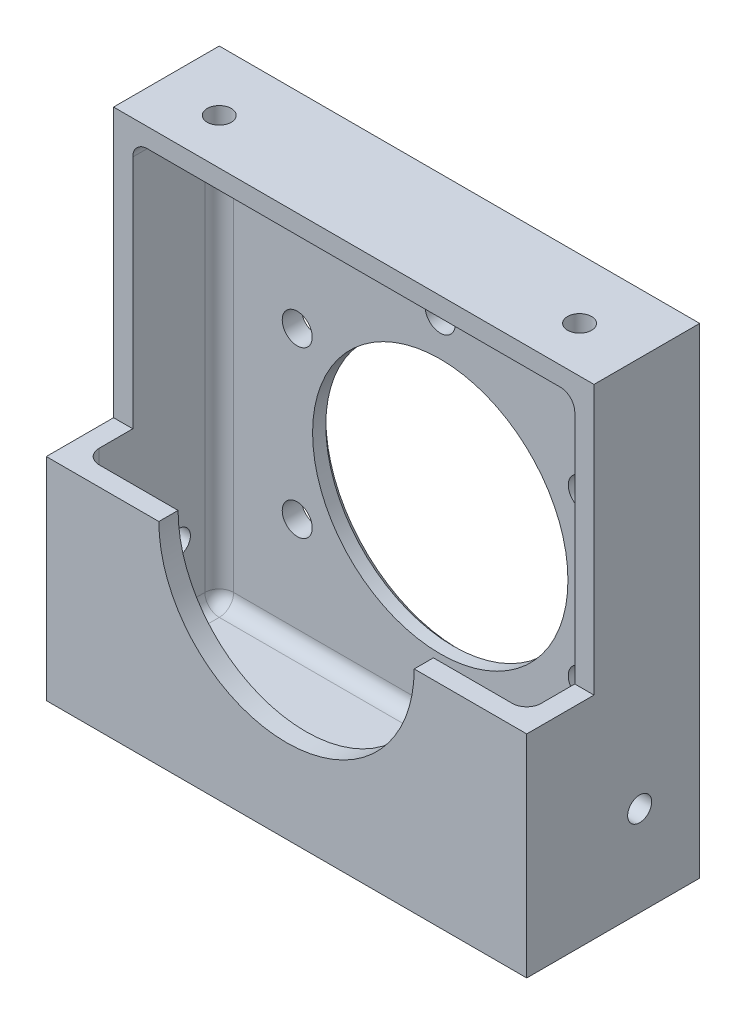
SolidWorks part; units mm, degrees
ref_plane "Front" through (0, 0, 0) normal (0, 0, 1) x (1, 0, 0)
ref_plane "Top" through (0, 0, 0) normal (0, 1, 0) x (1, 0, 0)
ref_plane "Right" through (0, 0, 0) normal (1, 0, 0) x (0, 0, -1)
sketch "Sketch1" plane through (0, 0, 0) normal (0, 0, 1) x (1, 0, 0)
  line L0 (0, 0) -> (50.8, 0)
  line L1 (0, 0) -> (0, 50.8)
  line L2 (50.8, 50.8) -> (0, 50.8)
  line L3 (50.8, 50.8) -> (50.8, 0)
  dimension "D1" = 50.8
extrude "main body" add sketch "Sketch1" along normal blind 18.288
sketch "Sketch2" plane through (50.8, 0, 0) normal (1, 0, 0) x (0, 0, -1)
  line L0 (-18.288, 50.8) -> (-11.176, 50.8)
  line L1 (-18.288, 50.8) -> (-18.288, 22.352)
  line L2 (-11.176, 22.352) -> (-18.288, 22.352)
  line L3 (-11.176, 22.352) -> (-11.176, 50.8)
  line L4 (-18.288, 0) -> (0, 0) construction
  line L5 (0, 50.8) -> (0, 0) construction
  dimension "D1" = 22.352
  dimension "D2" = 11.176
extrude "front cut" cut sketch "Sketch2" against normal through all
shell "Shell1" thickness 2.032
sketch "Sketch3" plane through (0, 0, 0) normal (0, 0, 1) x (1, 0, 0)
  line L0 (0, 22.352) -> (50.8, 22.352) construction
  circle A0 centre (25.4, 22.352) radius 13.5001
  dimension "D1" = 27.0002
extrude "center hole" cut sketch "Sketch3" along normal through all
fillet "fill060.vert" radius 1.524 4 edges at (2.032, 12.192, 16.256) (48.768, 12.192, 16.256) (2.032, 25.4, 2.032) (48.768, 25.4, 2.032)
fillet "fill060.tb" radius 1.524 13 edges at (2.032, 48.768, 7.366) (48.768, 48.768, 7.366) (2.032, 2.032, 9.144) (25.4, 48.768, 2.032) (48.3216, 48.768, 2.4784) (2.4784, 48.768, 2.4784) (25.4, 2.032, 2.032) (25.4, 2.032, 16.256) (48.768, 2.032, 9.144) (48.3216, 2.032, 15.8096) (48.3216, 2.032, 2.4784) (2.4784, 2.032, 15.8096) (2.4784, 2.032, 2.4784)
chamfer "cham025" distance 0.635 angle 45 1 edges at (38.9001, 22.352, 0)
sketch "Sketch4" plane through (0, 50.8, 0) normal (0, 1, 0) x (-1, 0, 0)
  line L0 (0, 6.35) -> (-50.8, 6.35) construction
  line L1 (0, 11.176) -> (0, 0) construction
  line L2 (-50.8, 11.176) -> (-50.8, 0) construction
  line L3 (-50.8, 0) -> (0, 0) construction
  line L4 (-25.4, 6.35) -> (-25.4, 0) construction
  line L5 (-25.4, 0.635) -> (-25.4, 2.032) construction
  circle A0 centre (-44.45, 6.35) radius 1.27
  circle A1 centre (-6.35, 6.35) radius 1.27
  dimension "D2" = 2.54
  dimension "D1" = 6.35
  dimension "D3" = 38.1
extrude "drill010.top" cut sketch "Sketch4" against normal up to next
sketch "Sketch6" plane through (50.8, 0, 0) normal (1, 0, 0) x (0, 0, -1)
  line L0 (-6.35, 50.8) -> (-6.35, 0) construction
  line L1 (-6.35, 48.768) -> (-6.35, 50.8) construction
  line L2 (-11.176, 50.8) -> (0, 50.8) construction
  line L3 (-18.288, 0) -> (0, 0) construction
  circle A0 centre (-6.35, 9.525) radius 1.27
  dimension "D1" = 2.54
  dimension "D2" = 9.525
extrude "drill010.sides" cut sketch "Sketch6" against normal through all
sketch "Sketch9" plane through (0, 0, 0) normal (0, 0, -1) x (-1, 0, 0)
  line L0 (-25.4, 22.352) -> (0, 22.352) construction
  line L1 (-25.4, 22.352) -> (0, 37.0167) construction
  line L2 (0, 0) -> (0, 50.8) construction
  circle A0 centre (-25.4, 22.352) radius 17.4625 construction
  circle A1 centre (-10.277, 31.0833) radius 1.5875
  dimension "D1" = 34.925
  dimension "D3" = 3.175
  dimension "D2" = 30
extrude "drill125" cut sketch "Sketch9" against normal up to next
pattern_circular "hole pattern" count 6 every 60 about axis through (25.4, 22.352, 0) along (0, 0, 1) of "drill125"
